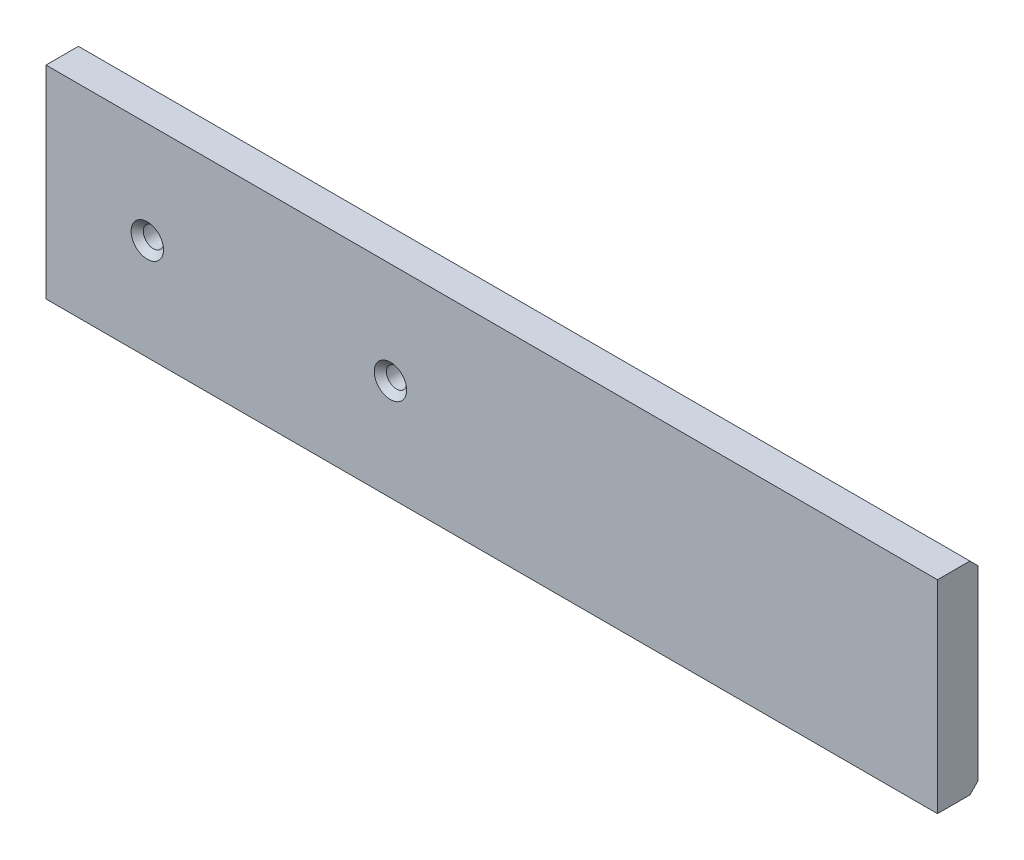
SolidWorks part; units mm, degrees
ref_plane "Plan de face" through (0, 0, 0) normal (0, 0, 1) x (1, 0, 0)
ref_plane "Plan de dessus" through (0, 0, 0) normal (0, 1, 0) x (1, 0, 0)
ref_plane "Plan de droite" through (0, 0, 0) normal (1, 0, 0) x (0, 0, -1)
sketch "Esquisse1" plane through (0, 0, 0) normal (0, 0, 1) x (1, 0, 0)
  line L0 (-39.245, 0) -> (109.1135, 0) construction
  line L2 (0, 25) -> (220, 25)
  line L3 (0, 25) -> (0, -25)
  line L4 (0, -25) -> (220, -25)
  line L5 (220, 25) -> (220, -25)
  dimension "D1" = 220
  dimension "D2" = 50
  dimension "D3" = 25
extrude "Boss.-Extru.1" add sketch "Esquisse1" along normal blind 10
sketch "Esquisse2" plane through (0, 0, 0) normal (0, 0, -1) x (-1, 0, 0)
  circle A0 centre (-25, 0) radius 2.5
  dimension "D2" = 5
  dimension "D1" = 25
extrude "Enlèv. mat.-Extru.1" cut sketch "Esquisse2" against normal through all
chamfer "Chanfrein1" distance 2 angle 45 2 edges at (110, 25, 0) (110, -25, 0)
chamfer "Chanfrein2" distance 1.5 angle 45 1 edges at (22.5, 0, 10)
pattern_linear "Répétition linéaire3" count 2 spacing 60 along (1, 0, 0) of "Enlèv. mat.-Extru.1", "Chanfrein2"
